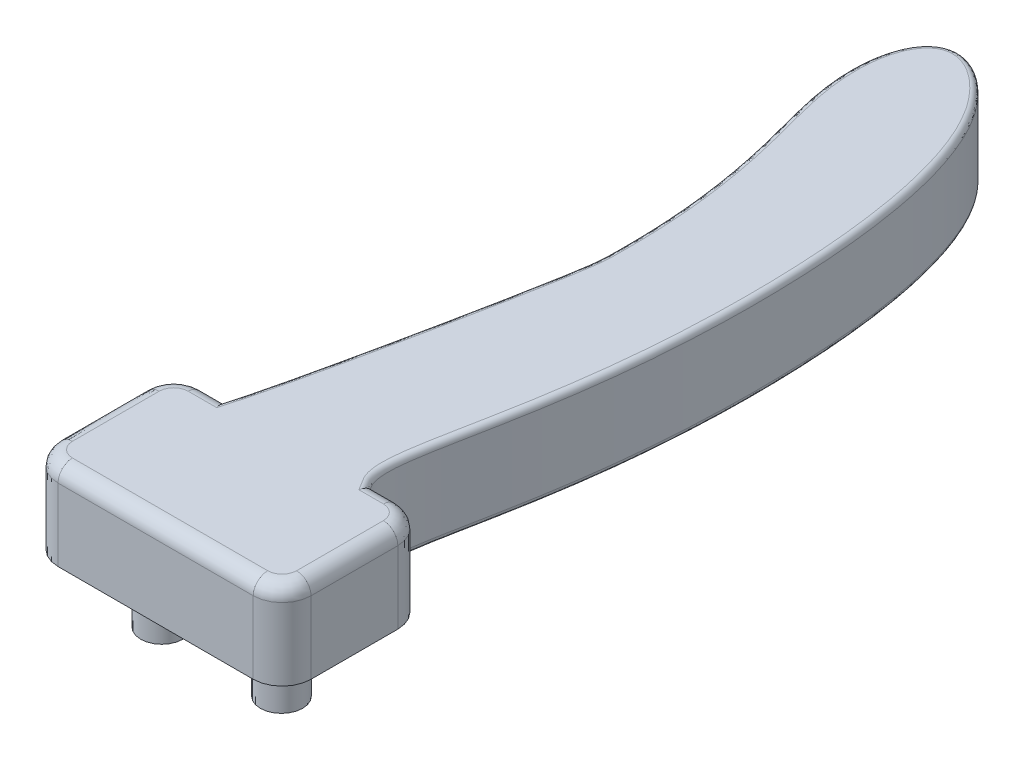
SolidWorks part; units mm, degrees
ref_plane "Front Plane" through (0, 0, 0) normal (0, 0, 1) x (1, 0, 0)
ref_plane "Top Plane" through (0, 0, 0) normal (0, 1, 0) x (1, 0, 0)
ref_plane "Right Plane" through (0, 0, 0) normal (1, 0, 0) x (0, 0, -1)
sketch "Sketch1" plane through (0, 0, 0) normal (0, 1, 0) x (1, 0, 0)
  line L0 (0, 0) -> (22.225, 0)
  line L1 (22.225, 0) -> (22.225, 12.7)
  line L2 (22.225, 12.7) -> (17.3484, 12.7)
  line L3 (0, 0) -> (0, 12.7)
  line L4 (0, 12.7) -> (4.8766, 12.7)
  spline S1 degree 3 poles (17.3484, 12.7) (15.8234, 15.1811) (21.7921, 28.8043) (19.8681, 63.9739) (9.326, 73.7826) (5.3503, 67.7417) (10.33, 50.7287) (10.5024, 43.3748) (10.39, 37.9408) (6.2268, 17.5406) (4.8766, 12.7) knots 0.019374 0.019374 0.019374 0.019374 0.303985 0.516151 0.559533 0.717996 0.756053 0.902049 0.92675 0.98481 0.98481 0.98481 0.98481
  dimension "D1" = 22.225
  dimension "D2" = 12.7
extrude "Boss-Extrude1" add sketch "Sketch1" along normal blind 7.62
fillet "Fillet1" radius 2.54 4 edges at (0, 3.81, -12.7) (0, 3.81, 0) (22.225, 3.81, 0) (22.225, 3.81, -12.7)
fillet "Fillet10" radius 1.27 9 edges at (0.7439, 7.62, -0.7439) (0, 7.62, -6.35) (3.7083, 7.62, -12.7) (0.7439, 7.62, -11.9561) (18.5167, 7.62, -12.7) (21.4811, 7.62, -11.9561) (22.225, 7.62, -6.35) (21.4811, 7.62, -0.7439) (11.1125, 7.62, 0)
sketch "Sketch2" plane through (0, 0, 0) normal (0, -1, 0) x (1, 0, 0)
  line L0 (11.1125, -5.7969) -> (16.3671, -5.7969) construction
  line L3 (2.54, 0) -> (19.685, 0) construction
  line L4 (11.1125, -5.7969) -> (11.1125, 0) construction
  line L6 (5.8579, -5.7969) -> (11.1125, -5.7969) construction
  circle A0 centre (5.8579, -5.7969) radius 1.8574
  circle A1 centre (16.3671, -5.7969) radius 1.8574
  point P4 (4.0005, -5.7969)
  point P5 (18.2245, -5.7969)
  point P16 (11.1125, 0)
  point P17 (11.1125, -5.7969)
  dimension "D2" = 3.7147
  dimension "D1" = 14.224
extrude "Boss-Extrude2" add sketch "Sketch2" along normal blind 5.842
ref_plane "Plane1" through (-7.62, 0, 0) normal (-1, 0, 0) x (0, 0, 1)
fillet "Fillet11" radius 0.508 2 edges
